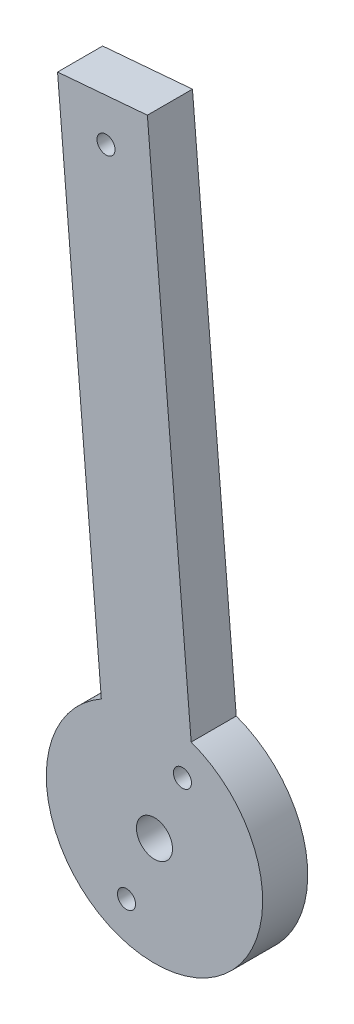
SolidWorks part; units mm, degrees
ref_plane "Front Plane" through (0, 0, 0) normal (0, 0, 1) x (1, 0, 0)
ref_plane "Top Plane" through (0, 0, 0) normal (0, 1, 0) x (1, 0, 0)
ref_plane "Right Plane" through (0, 0, 0) normal (1, 0, 0) x (0, 0, -1)
sketch "Sketch1" plane through (0, 0, 0) normal (0, 0, 1) x (1, 0, 0)
  line L1 (0, 0) -> (-0.6679, 7.9492) construction
  line L3 (-5.8958, 10.4518) -> (-10.7519, 68.2481)
  line L4 (-10.7519, 68.2481) -> (-0.787, 69.0854)
  line L5 (-0.787, 69.0854) -> (4.0691, 11.289)
  arc A0 (-5.8958, 10.4518) -> (4.0691, 11.289) centre (0, 0) ccw
  dimension "D1" = 58
extrude "Boss-Extrude1" add sketch "Sketch1" along normal blind 5
sketch "Sketch2" plane through (0, 0, 5) normal (0, 0, 1) x (1, 0, 0)
  line L0 (0, 0) -> (-5.7695, 68.6668) construction
  line L1 (-0.787, 69.0854) -> (-10.7519, 68.2481) construction
  circle A0 centre (0, 0) radius 2
  circle A1 centre (-5.3748, 63.9692) radius 1
  dimension "D1" = 64.1946
extrude "Cut-Extrude1" cut sketch "Sketch2" against normal blind 5
sketch "Sketch3" plane through (0, 0, 5) normal (0, 0, 1) x (1, 0, 0)
  line L0 (0, 0) -> (9.4556, 0) construction
  line L1 (0, 0) -> (3.4442, 8.1794) construction
  line L2 (0, 0) -> (-3.2811, -7.792) construction
  circle A0 centre (3.1047, 7.373) radius 1
  circle A1 centre (-3.1047, -7.373) radius 1
  circle A2 centre (0, 0) radius 2 construction
  dimension "D3" = 8
  dimension "D4" = 8
  dimension "D1" = 67.165
  dimension "D2" = 180
extrude "Cut-Extrude2" cut sketch "Sketch3" against normal blind 10
sketch "Sketch4" plane through (0, 0, 5) normal (0, 0, 1) x (1, 0, 0)
  line L0 (0, 0) -> (11.0929, 0)
